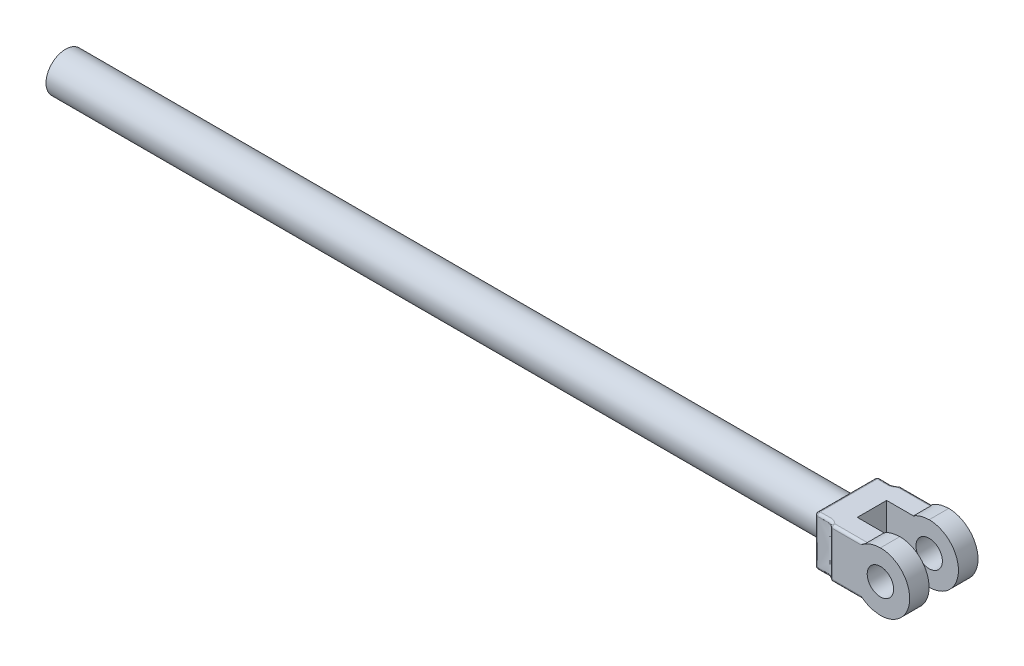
SolidWorks part; units mm, degrees
ref_plane "Front Plane" through (0, 0, 0) normal (0, 0, 1) x (1, 0, 0)
ref_plane "Top Plane" through (0, 0, 0) normal (0, 1, 0) x (1, 0, 0)
ref_plane "Right Plane" through (0, 0, 0) normal (1, 0, 0) x (0, 0, -1)
sketch "Sketch1" plane through (0, 0, 0) normal (0, 1, 0) x (1, 0, 0)
  line L0 (0, 0) -> (0, -18.9358)
  line L1 (0, -18.9358) -> (-95.3262, -18.9358)
  line L2 (-95.3262, -18.9358) -> (-95.3262, 47.744)
  line L3 (-95.3262, 47.744) -> (0, 47.744)
  line L4 (0, 47.744) -> (0, 28.6464)
  line L5 (0, 28.6464) -> (-70.0785, 28.6464)
  line L6 (-70.0785, 28.6464) -> (-70.0785, 0)
  line L7 (-70.0785, 0) -> (0, 0)
  dimension "D1" = 70.0785
  dimension "D2" = 95.3262
  dimension "D3" = 28.6464
  dimension "D4" = 47.744
  dimension "D5" = 18.9358
extrude "Extrude1" add sketch "Sketch1" along normal blind 57.15
sketch "Sketch2" plane through (0, 57.15, 0) normal (0, 1, 0) x (1, 0, 0)
  line L0 (0, 47.744) -> (-95.3262, 47.744) construction
  line L1 (-95.3262, 47.744) -> (-95.3262, -18.9358) construction
  line L2 (-99.8575, 44.7742) -> (-90.7948, 44.7742) construction
  line L4 (0, 28.6464) -> (0, 47.744) construction
  line L5 (-70.0785, 28.6464) -> (0, 28.6464) construction
  spline S0 degree 3 poles (-76.1925, 47.744) (-78.1871, 46.1977) (-80.1816, 44.6514) (-86.6359, 44.6514) (-89.2687, 44.7742) (-95.3262, 44.7742) knots 0 0 0 0 0.351544 0.351544 1 1 1 1
  dimension "D1" = 76.1925
  dimension "D2" = 82.4506
  dimension "D4" = 16.1278
extrude "Cut-Extrude1" cut sketch "Sketch2" against normal through all flip side to cut
ref_plane "Plane1" through (0, 0, -14.351) normal (0, 0, 1) x (1, 0, 0)
mirror "Mirror1" about plane through (0, 0, -14.351) normal (0, 0, 1) of "Cut-Extrude1"
sketch "Sketch3" plane through (0, 0, 18.9358) normal (0, 0, 1) x (1, 0, 0)
  line L0 (0, 57.15) -> (0, 0) construction
  line L1 (-76.3296, 57.15) -> (0, 57.15) construction
  circle A0 centre (-28.575, 28.575) radius 28.575
  dimension "D1" = 57.15
  dimension "D2" = 28.575
  dimension "D3" = 28.575
sketch "Sketch4" plane through (0, 0, 18.9358) normal (0, 0, 1) x (1, 0, 0)
  circle A0 centre (-28.575, 28.575) radius 12.8905
  dimension "D1" = 25.781
extrude "Cut-Extrude2" cut sketch "Sketch4" against normal through all
sketch "Sketch5" plane through (0, 0, 18.9358) normal (0, 0, 1) x (1, 0, 0)
  line L0 (-28.575, 0) -> (0, 0)
  line L1 (0, 28.575) -> (0, 0)
  line L2 (0, 57.15) -> (-28.575, 57.15)
  line L3 (-28.575, 57.15) -> (-28.7048, 57.2271)
  line L4 (0, 57.15) -> (0, 0) construction
  line L5 (-76.3296, 57.15) -> (0, 57.15) construction
  line L6 (0, 28.575) -> (0, 57.15)
  arc A0 (-28.575, 57.15) -> (-28.575, 0) centre (-28.575, 28.575) cw
  circle A1 centre (-28.575, 28.575) radius 28.575 construction
  dimension "D1" = 28.7048
  dimension "D2" = 0.0771
extrude "Cut-Extrude3" cut sketch "Sketch5" against normal through all
sketch "Sketch7" plane through (0, 0, 0) normal (0, 0, 1) x (1, 0, 0)
  line L0 (-95.3262, 52.687) -> (-43.9094, 52.687)
  line L1 (-95.3262, 57.15) -> (-95.3262, 0) construction
  line L2 (-95.3262, 52.687) -> (-95.3262, 57.15)
  line L3 (-95.3262, 57.15) -> (-28.575, 57.15)
  circle A0 centre (-28.575, 28.575) radius 28.575 construction
  spline S0 degree 3 poles (-43.9094, 52.687) (-41.7463, 54.0626) (-36.8362, 56.4375) (-31.4321, 56.9036) (-28.575, 57.15) knots 0 0 0 0 0.471295 1 1 1 1
  dimension "D1" = 37.0084
  dimension "D2" = 43.9094
  dimension "D3" = 55.8772
extrude "Cut-Extrude4" cut sketch "Sketch7" against normal through all and the other way through all
ref_plane "Plane2" through (0, 28.575, 0) normal (0, 1, 0) x (-1, 0, 0)
mirror "Mirror2" about plane through (0, 28.575, 0) normal (0, 1, 0) of "Cut-Extrude4"
sketch "Sketch9" plane through (-95.3262, 0, 0) normal (-1, 0, 0) x (0, 0, 1)
  line L0 (16.0722, 52.687) -> (16.0722, 4.463) construction
  line L1 (-44.7742, 4.463) -> (16.0722, 4.463) construction
  circle A0 centre (-14.351, 28.575) radius 19.05
  dimension "D1" = 38.1
  dimension "D2" = 30.4232
  dimension "D3" = 24.112
extrude "Extrude2" add sketch "Sketch9" along normal blind 762
fillet "Fillet1" radius 2.54 14 edges at (-60.1195, 52.687, 18.9358) (-95.3262, 4.463, -14.351) (-60.051, 4.463, -47.744) (-95.3262, 28.575, 16.0722) (-76.1925, 28.575, -47.744) (-95.3262, 28.575, -44.7742) (-95.3262, 52.687, -14.351) (-60.051, 52.687, -47.744)
